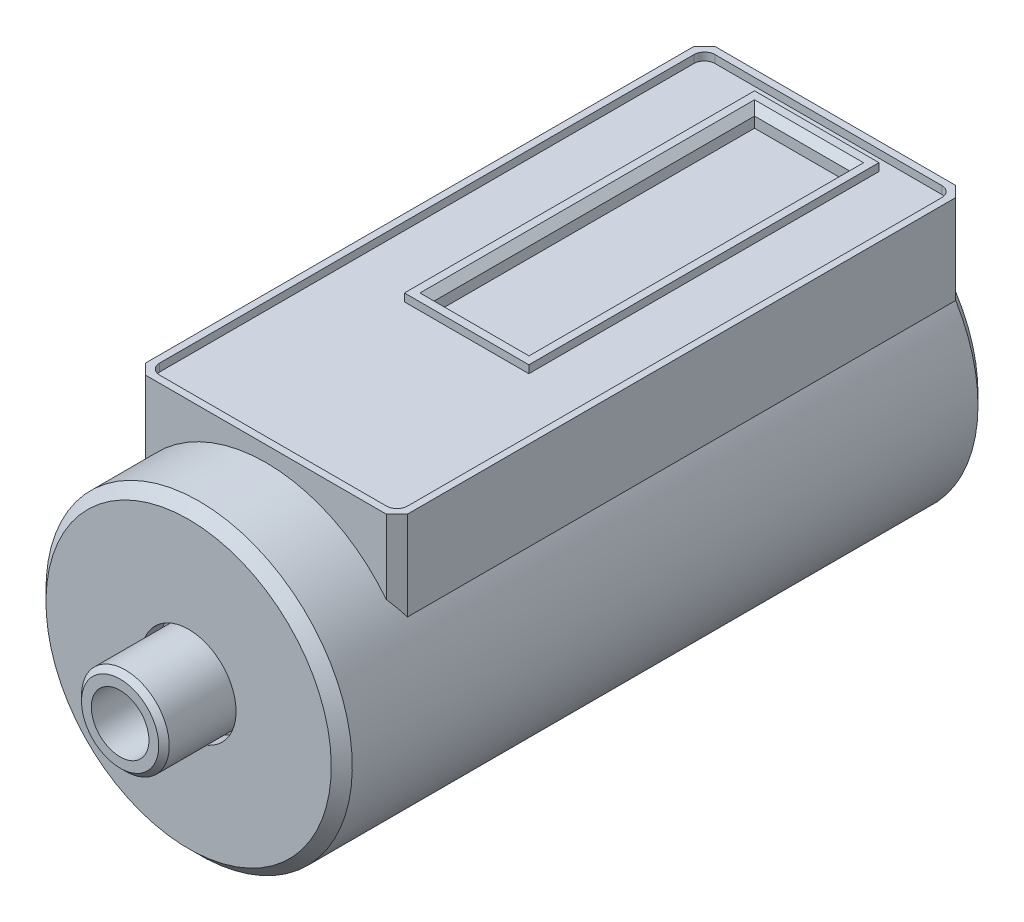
SolidWorks part; units mm, degrees
ref_plane "Front" through (0, 0, 0) normal (0, 0, 1) x (1, 0, 0)
ref_plane "Top" through (0, 0, 0) normal (0, 1, 0) x (1, 0, 0)
ref_plane "Right" through (0, 0, 0) normal (1, 0, 0) x (0, 0, -1)
sketch "Sketch2" plane through (0, 0, 0) normal (1, 0, 0) x (0, 0, -1)
  line L0 (161.035, 0) -> (161.035, 2.79)
  line L1 (161.415, 3.17) -> (167.255, 3.17)
  line L2 (165.985, 3.43) -> (165.985, 10.31)
  line L3 (166.745, 11.07) -> (212.725, 11.07)
  line L4 (212.725, 11.07) -> (212.725, 0)
  line L5 (212.725, 0) -> (161.035, 0)
  line L6 (165.985, 3.43) -> (167.255, 3.43)
  line L7 (167.255, 3.43) -> (167.255, 3.17)
  line L8 (161.035, 2.79) -> (161.415, 3.17)
  line L9 (165.985, 10.31) -> (166.745, 11.07)
  dimension "D1" = 51.69
  dimension "D2" = 3.17
  dimension "D3" = 11.07
  dimension "D4" = 4.95
  dimension "D5" = 1.27
  dimension "D6" = 3.43
  dimension "D7" = 2.79
  dimension "D8" = 0.38
  dimension "D9" = 0.76
  dimension "D10" = 10.31
  dimension "D11" = 212.725
revolve "Revolve1" add sketch "Sketch2" angle 360 about L5
sketch "Sketch3" plane through (0, 0, 0) normal (0, 1, 0) x (1, 0, 0)
  line L0 (11.07, 212.725) -> (-11.07, 212.725) construction
  line L1 (-9.46, 212.725) -> (9.46, 212.725)
  line L2 (-9.46, 212.725) -> (-9.46, 172.335)
  line L3 (-8.7, 171.575) -> (8.7, 171.575)
  line L4 (9.46, 212.725) -> (9.46, 172.335)
  line L5 (-9.46, 172.335) -> (-8.7, 171.575)
  line L6 (9.46, 172.335) -> (8.7, 171.575)
  point P1 (9.46, 171.575)
  point P2 (-9.46, 171.575)
  point P6 (0, 171.575)
  dimension "D1" = 41.15
  dimension "D2" = 18.92
extrude "Extrude1" add sketch "Sketch3" along normal blind 12.19
chamfer "Chamfer1" distance 0.76 angle 45 3 edges at (-9.46, 8.9696, -212.725) (0, -11.07, -212.725) (9.46, 8.9696, -212.725)
sketch "Sketch4" plane through (0, 12.19, 0) normal (0, 1, 0) x (1, 0, 0)
  line L0 (-8.7, 171.575) -> (8.7, 171.575) construction
  line L1 (-8.19, 212.215) -> (8.2, 212.215)
  line L2 (-8.95, 211.455) -> (-8.95, 172.845)
  line L3 (-8.19, 172.085) -> (8.2, 172.085)
  line L4 (8.96, 211.455) -> (8.96, 172.845)
  line L5 (-9.46, 172.335) -> (-9.46, 211.965) construction
  line L7 (-4.49, 211.375) -> (4.5, 211.375)
  line L8 (-4.49, 211.375) -> (-4.49, 186.075)
  line L9 (-4.49, 186.075) -> (4.5, 186.075)
  line L10 (4.5, 211.375) -> (4.5, 186.075)
  arc A0 (-8.95, 211.455) -> (-8.19, 212.215) centre (-8.19, 211.455) cw
  arc A1 (8.96, 211.455) -> (8.2, 212.215) centre (8.2, 211.455) ccw
  arc A2 (8.96, 172.845) -> (8.2, 172.085) centre (8.2, 172.845) cw
  arc A3 (-8.95, 172.845) -> (-8.19, 172.085) centre (-8.19, 172.845) ccw
  dimension "D5" = 0.76
  dimension "D1" = 17.91
  dimension "D2" = 40.13
  dimension "D3" = 0.51
  dimension "D4" = 0.51
  dimension "D6" = 0.84
  dimension "D7" = 4.46
  dimension "D8" = 4.46
  dimension "D9" = 25.3
extrude "Cut-Extrude1" cut sketch "Sketch4" against normal blind 0.56
sketch "Sketch5" plane through (0, 12.19, 0) normal (0, 1, 0) x (1, 0, 0)
  line L1 (-3.42, 210.305) -> (3.44, 210.305)
  line L2 (-3.42, 210.305) -> (-3.42, 187.145)
  line L3 (-3.42, 187.145) -> (3.44, 187.145)
  line L4 (3.44, 210.305) -> (3.44, 187.145)
  line L6 (4.5, 211.375) -> (-4.49, 211.375) construction
  line L7 (-4.49, 211.375) -> (-4.49, 186.075) construction
  point P4 (0.005, 211.375)
  dimension "D1" = 6.86
  dimension "D2" = 23.16
  dimension "D3" = 1.07
  dimension "D4" = 1.07
extrude "Cut-Extrude2" cut sketch "Sketch5" against normal blind 1.27
chamfer "Chamfer2" distance 0.51 angle 45 4 edges at (0.01, 12.19, -187.145) (3.44, 12.19, -198.725) (-3.42, 12.19, -198.725) (0.01, 12.19, -210.305)
hole_wizard "Hole1" positions "Sketch7" profile "Sketch6" legacy
sketch "Sketch7" plane through (0, 0, -161.035) normal (0, 0, 1) x (1, 0, 0)
  circle A0 centre (0, 0) radius 3.17 construction
  point P0 (0, 0)
sketch "Sketch6" plane through (0, 0, -161.035) normal (1, 0, 0) x (0, -1, 0)
  line L0 (0, 0) -> (0, 7.6015)
  line L1 (0, 7.6015) -> (2.0828, 6.35)
  line L2 (2.0828, 6.35) -> (2.0828, 0)
  line L4 (2.0828, 0) -> (0, 0)
  line L6 (0, 7.6015) -> (-2.0828, 6.35) construction
  line L7 (0, -4.2442) -> (0, 117.3081) construction
  dimension "Diameter" = 4.1656
  dimension "Depth" = 6.35
  dimension "Drill Angle" = 118
